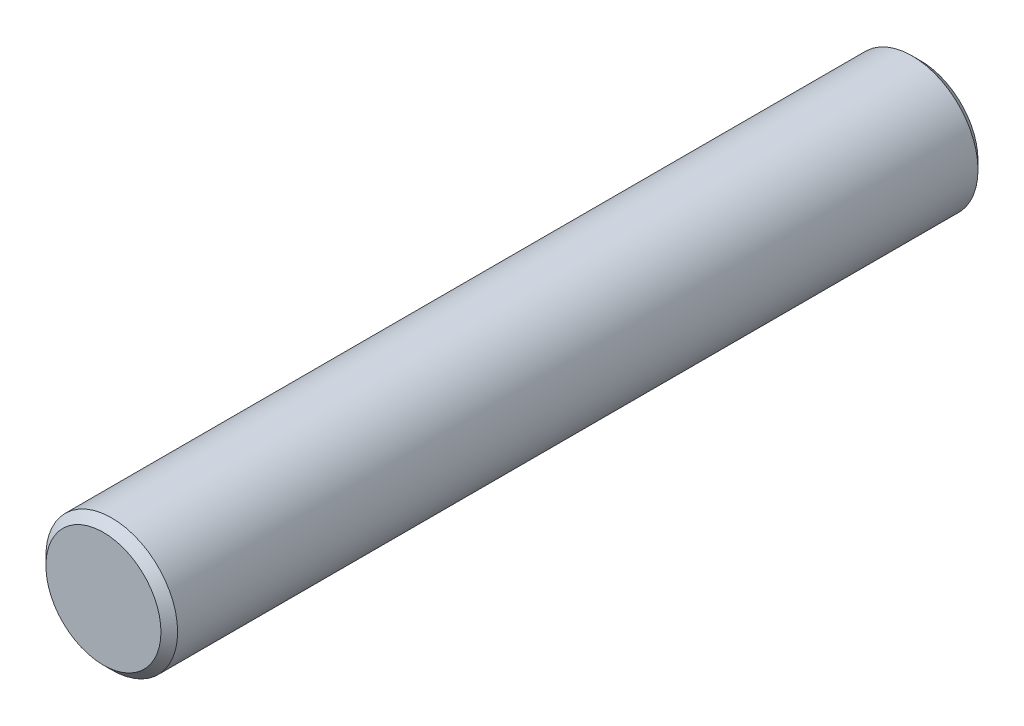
SolidWorks part; units mm, degrees
ref_plane "Ön Düzlem" through (0, 0, 0) normal (0, 0, 1) x (1, 0, 0)
ref_plane "Üst Düzlem" through (0, 0, 0) normal (0, 1, 0) x (1, 0, 0)
ref_plane "Sağ Düzlem" through (0, 0, 0) normal (1, 0, 0) x (0, 0, -1)
sketch "Çizim1" plane through (0, 0, 0) normal (0, 0, 1) x (1, 0, 0)
  circle A0 centre (0, 0) radius 3.95
  dimension "D1" = 7.9
extrude "Yükseklik-Ekstrüzyon1" add sketch "Çizim1" along normal mid plane 49
chamfer "Pah1" distance 0.5 angle 45 2 edges at (3.95, 0, -24.5) (3.95, 0, 24.5)
